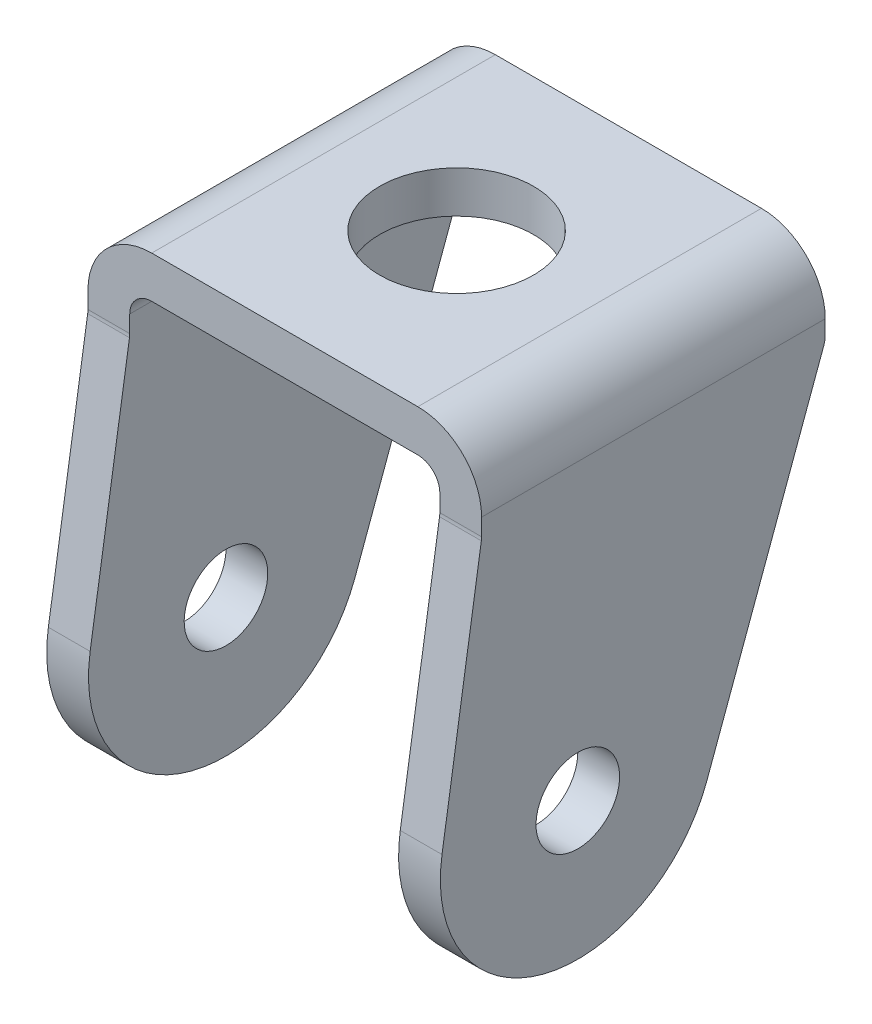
SolidWorks part; units mm, degrees
ref_plane "Front" through (0, 0, 0) normal (0, 0, 1) x (1, 0, 0)
ref_plane "Top" through (0, 0, 0) normal (0, 1, 0) x (1, 0, 0)
ref_plane "Right" through (0, 0, 0) normal (1, 0, 0) x (0, 0, -1)
sketch "Sketch1" plane through (0, 0, 0) normal (0, 0, 1) x (1, 0, 0)
  line L0 (0, 0) -> (45.466, 0)
  line L1 (0, 0) -> (0, -57.15)
  line L2 (45.466, 0) -> (45.466, -57.15)
  dimension "D1" = 45.466
  dimension "D2" = 57.15
extrude "Extrude-Thin2" add sketch "Sketch1" along normal blind 44.45 thin
sketch "Sketch3" plane through (45.466, 0, 0) normal (1, 0, 0) x (0, 0, -1)
  line L0 (-44.45, 0) -> (0, 0) construction
  line L1 (0, 0) -> (0, -9.525)
  line L2 (0, 25.0063) -> (0, -25.0063) construction
  line L3 (0, -9.525) -> (-13.6736, -46.7488)
  line L4 (-44.2602, -38.8273) -> (-39.6875, -9.525)
  line L5 (-39.6875, -9.525) -> (-39.6875, 0)
  line L6 (-39.6875, 0) -> (0, 0)
  line L7 (-44.45, 0) -> (-44.45, -57.15) construction
  circle A0 centre (-28.575, -41.275) radius 15.875
  dimension "D3" = 31.75
  dimension "D1" = 41.275
  dimension "D2" = 39.6875
  dimension "D5" = 9.525
  dimension "D6" = 9.525
extrude "Cut-Extrude3" cut sketch "Sketch3" against normal through all contours A0 L4 L5 M3 M2 | A0 M4 M3 | L3 A0 M4 M1
sketch "Sketch4" plane through (0, 0, 0) normal (-1, 0, 0) x (0, 0, 1)
  circle A0 centre (28.575, -41.275) radius 4.826
  arc A2 (13.6736, -46.7488) -> (44.2602, -38.8273) centre (28.575, -41.275) ccw construction
  dimension "D1" = 9.652
extrude "Cut-Extrude4" cut sketch "Sketch4" against normal through all
sketch "Sketch5" plane through (0, 0, 0) normal (0, 1, 0) x (-1, 0, 0)
  line L0 (-45.466, 39.6875) -> (0, 0) construction
  circle A0 centre (-22.733, 19.8438) radius 8.89
  dimension "D1" = 17.78
extrude "Cut-Extrude5" cut sketch "Sketch5" against normal through all
fillet "Fillet1" radius 2.54 6 edges at (43.053, -9.525, 0) (2.413, -9.525, 0) (43.053, -9.525, 39.6875) (2.413, -9.525, 39.6875) (4.826, -4.826, 19.8438) (40.64, -4.826, 19.8438)
fillet "Fillet2" radius 7.366 2 edges at (45.466, 0, 19.8438) (0, 0, 19.8438)
